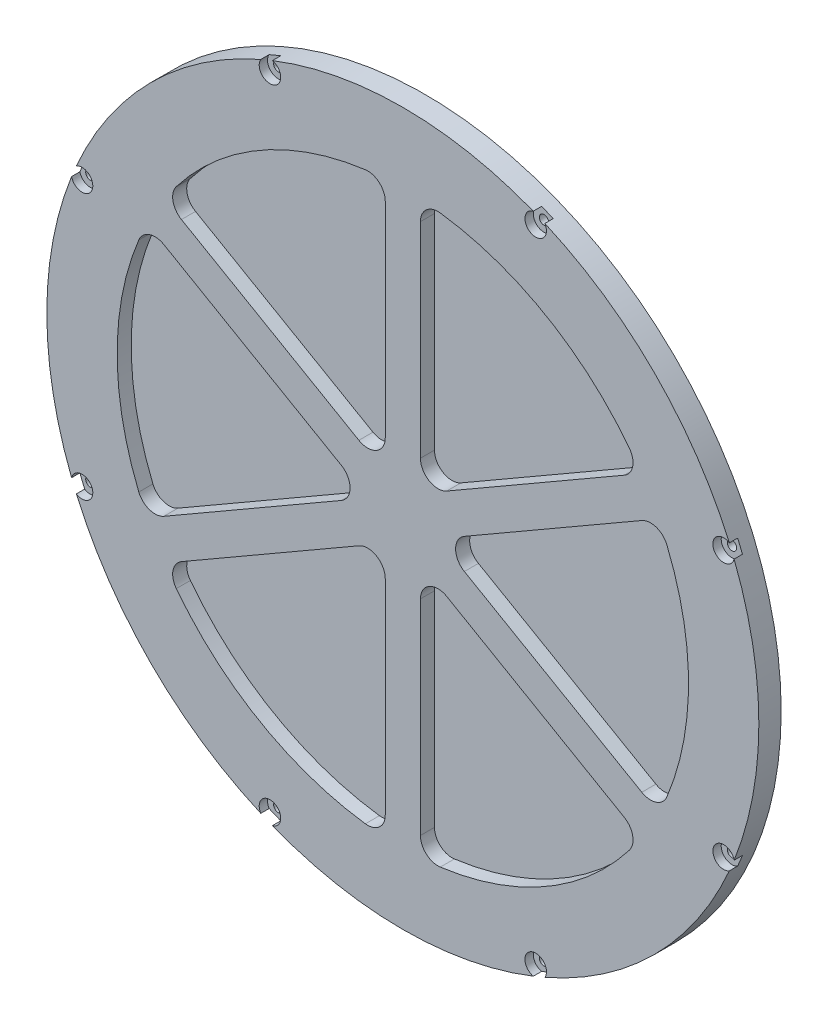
SolidWorks part; units mm, degrees
ref_plane "Front Plane" through (0, 0, 0) normal (0, 0, 1) x (1, 0, 0)
ref_plane "Top Plane" through (0, 0, 0) normal (0, 1, 0) x (1, 0, 0)
ref_plane "Right Plane" through (0, 0, 0) normal (1, 0, 0) x (0, 0, -1)
sketch "Sketch1" plane through (0, 0, 0) normal (0, 0, 1) x (1, 0, 0)
  line L0 (0, 74.0826) -> (0, -98.2025) construction
  line L1 (-101.5333, 0) -> (146.3274, 0) construction
  circle A0 centre (0, 0) radius 202.5
  dimension "D2" = 405
extrude "Boss-Extrude1" add sketch "Sketch1" along normal mid plane 12.7
sketch "Sketch2" plane through (0, 0, 6.35) normal (0, 0, 1) x (1, 0, 0)
  line L0 (0, 212.952) -> (0, -223.7918) construction
  line L1 (-207.1672, 0) -> (208.5976, 0) construction
  line L2 (197.5, 81.8072) -> (197.5, -81.8072) construction
  line L3 (-197.5, 81.8072) -> (-197.5, -81.8072) construction
  line L4 (-197.5, -81.8072) -> (-81.8072, -197.5) construction
  line L5 (81.8072, -197.5) -> (197.5, -81.8072) construction
  line L6 (81.8072, -197.5) -> (-81.8072, -197.5) construction
  line L7 (-197.5, 81.8072) -> (-81.8072, 197.5) construction
  line L8 (81.8072, 197.5) -> (197.5, 81.8072) construction
  line L9 (81.8072, 197.5) -> (-81.8072, 197.5) construction
  dimension "D1" = 197.5
  dimension "D2" = 197.5
  dimension "D3" = 135
  dimension "D4" = 135
  dimension "D5" = 197.5
sketch "Sketch3" plane through (0, 0, 6.35) normal (0, 0, 1) x (1, 0, 0)
  line L0 (-44.7214, 197.5) -> (44.7214, 197.5)
  line L1 (108.0308, 171.2764) -> (171.2764, 108.0308)
  line L2 (197.5, 44.7214) -> (197.5, -44.7214)
  line L3 (171.2764, -108.0308) -> (108.0308, -171.2764)
  line L4 (44.7214, -197.5) -> (-44.7214, -197.5)
  line L5 (-108.0308, -171.2764) -> (-171.2764, -108.0308)
  line L6 (-197.5, -44.7214) -> (-197.5, 44.7214)
  line L7 (-171.2764, 108.0308) -> (-108.0308, 171.2764)
  line L9 (-197.5, -81.8072) -> (-81.8072, -197.5) construction
  arc A0 (108.0308, 171.2764) -> (44.7214, 197.5) centre (0, 0) ccw
  arc A1 (-44.7214, 197.5) -> (-108.0308, 171.2764) centre (0, 0) ccw
  arc A2 (-171.2764, 108.0308) -> (-197.5, 44.7214) centre (0, 0) ccw
  arc A3 (-197.5, -44.7214) -> (-171.2764, -108.0308) centre (0, 0) ccw
  arc A4 (-108.0308, -171.2764) -> (-44.7214, -197.5) centre (0, 0) ccw
  arc A5 (44.7214, -197.5) -> (108.0308, -171.2764) centre (0, 0) ccw
  arc A6 (171.2764, -108.0308) -> (197.5, -44.7214) centre (0, 0) ccw
  arc A7 (197.5, 44.7214) -> (171.2764, 108.0308) centre (0, 0) ccw
  dimension "D1" = 405
extrude "Cut-Extrude1" [suppressed] cut sketch "Sketch3" against normal blind 406.4 flip side to cut
sketch "Sketch10" plane through (0, 0, 6.35) normal (0, 0, -1) x (-1, 0, 0)
  line L0 (77.4934, 187.0856) -> (-77.4934, -187.0856) construction
  line L1 (77.4934, -187.0856) -> (-77.4934, 187.0856) construction
  line L2 (187.0856, 77.4934) -> (-187.0856, -77.4934) construction
  line L3 (-187.0856, 77.4934) -> (187.0856, -77.4934) construction
  circle A0 centre (0, 0) radius 202.5 construction
  circle A1 centre (0, 0) radius 202.5 construction
  circle A2 centre (0, 0) radius 202.5 construction
  circle A3 centre (0, 0) radius 202.5 construction
  circle A4 centre (0, 0) radius 202.5 construction
  circle A5 centre (0, 0) radius 202.5 construction
  circle A6 centre (0, 0) radius 202.5 construction
  circle A7 centre (0, 0) radius 202.5 construction
  circle A8 centre (0, 0) radius 197.5 construction
  circle A9 centre (182.4662, 75.58) radius 2.2479
  circle A10 centre (75.58, 182.4662) radius 2.2479
  circle A11 centre (-75.58, 182.4662) radius 2.2479
  circle A12 centre (182.4662, -75.58) radius 2.2479
  circle A13 centre (75.58, -182.4662) radius 2.2479
  circle A14 centre (-182.4662, 75.58) radius 2.2479
  circle A15 centre (-182.4662, -75.58) radius 2.2479
  circle A16 centre (-75.58, -182.4662) radius 2.2479
  dimension "D1" = 395
  dimension "D2" = 4.4958
extrude "Cut-Extrude3" [suppressed] cut sketch "Sketch10" against normal up to surface (10 mm away)
hole_wizard "CBORE for M5 Hex Head Bolt1" positions "3DSketch1" profile "Sketch11" counterbore size "M5" standard "Ansi Metric"
sketch3d "3DSketch1"
  point P0 (-75.58, 182.4662, 6.35)
sketch "Sketch11" plane through (-75.58, 182.4662, 6.35) normal (1, 0, 0) x (0, -1, 0)
  line L0 (0, 0) -> (0, 12.7)
  line L1 (0, 12.7) -> (2.65, 12.7)
  line L3 (2.65, 12.7) -> (2.65, 4.74)
  line L4 (2.65, 4.74) -> (6.12, 4.74)
  line L5 (6.12, 4.74) -> (6.12, 0)
  line L7 (6.12, 0) -> (0, 0)
  line L11 (0, -6.35) -> (0, 107.95) construction
  dimension "Thru Hole Dia." = 5.3
  dimension "Thru Hole Depth" = 12.7
  dimension "C'Bore Dia." = 12.24
  dimension "C'Bore Depth" = 4.74
sketch "Sketch13" plane through (0, 0, 6.35) normal (0, 0, 1) x (1, 0, 0)
  line L0 (0, 219.8273) -> (0, -231.8135) construction
  line L1 (10, 151.1828) -> (10, 34.641)
  line L2 (206.514, 119.2309) -> (-206.514, -119.2309) construction
  line L3 (-218.6634, 126.2454) -> (218.6634, -126.2454) construction
  line L4 (-10, 151.1828) -> (-10, 34.641)
  line L5 (-125.9282, 84.2517) -> (-25, 25.9808)
  line L6 (125.9282, -84.2517) -> (25, -25.9808)
  line L7 (125.9282, 84.2517) -> (25, 25.9808)
  line L8 (-125.9282, -84.2517) -> (-25, -25.9808)
  line L9 (-35, -8.6603) -> (-135.9282, -66.9312)
  line L10 (35, -8.6603) -> (135.9282, -66.9312)
  line L12 (-10, -34.641) -> (-10, -151.1828)
  line L13 (-35, 8.6603) -> (-135.9282, 66.9312)
  line L14 (35, 8.6603) -> (135.9282, 66.9312)
  line L15 (10, -34.641) -> (10, -151.1828)
  arc A0 (128.8579, 99.0045) -> (21.3115, 161.0965) centre (0, 0) ccw
  arc A1 (150.1694, -62.092) -> (150.1694, 62.092) centre (0, 0) ccw
  arc A2 (-128.8579, -99.0045) -> (-21.3115, -161.0965) centre (0, 0) ccw
  arc A3 (-150.1694, 62.092) -> (-150.1694, -62.092) centre (0, 0) ccw
  arc A4 (-21.3115, 161.0965) -> (-128.8579, 99.0045) centre (0, 0) ccw
  arc A5 (21.3115, -161.0965) -> (128.8579, -99.0045) centre (0, 0) ccw
  arc A6 (-25, 25.9808) -> (-10, 34.641) centre (-20, 34.641) ccw
  arc A7 (-10, 151.1828) -> (-21.3115, 161.0965) centre (-20, 151.1828) ccw
  arc A8 (-128.8579, 99.0045) -> (-125.9282, 84.2517) centre (-120.9282, 92.9119) ccw
  arc A9 (-135.9282, -66.9312) -> (-150.1694, -62.092) centre (-140.9282, -58.2709) cw
  arc A10 (-135.9282, 66.9312) -> (-150.1694, 62.092) centre (-140.9282, 58.2709) ccw
  arc A11 (-35, -8.6603) -> (-35, 8.6603) centre (-40, 0) ccw
  arc A12 (-10, -34.641) -> (-25, -25.9808) centre (-20, -34.641) ccw
  arc A13 (-128.8579, -99.0045) -> (-125.9282, -84.2517) centre (-120.9282, -92.9119) cw
  arc A14 (-21.3115, -161.0965) -> (-10, -151.1828) centre (-20, -151.1828) ccw
  arc A15 (128.8579, -99.0045) -> (125.9282, -84.2517) centre (120.9282, -92.9119) ccw
  arc A16 (21.3115, -161.0965) -> (10, -151.1828) centre (20, -151.1828) cw
  arc A17 (10, -34.641) -> (25, -25.9808) centre (20, -34.641) cw
  arc A18 (35, -8.6603) -> (35, 8.6603) centre (40, 0) cw
  arc A19 (135.9282, -66.9312) -> (150.1694, -62.092) centre (140.9282, -58.2709) ccw
  arc A20 (150.1694, 62.092) -> (135.9282, 66.9312) centre (140.9282, 58.2709) ccw
  arc A21 (125.9282, 84.2517) -> (128.8579, 99.0045) centre (120.9282, 92.9119) ccw
  arc A22 (25, 25.9808) -> (10, 34.641) centre (20, 34.641) cw
  arc A23 (10, 151.1828) -> (21.3115, 161.0965) centre (20, 151.1828) cw
  point P27 (-10, 162.192)
  point P37 (-145.4624, 72.4358)
  point P40 (-20, 0)
  point P45 (-135.4624, -89.7563)
  point P48 (-10, -162.192)
  point P53 (10, -162.192)
  point P58 (20, 0)
  point P61 (145.4624, -72.4358)
  dimension "D1" = 325
  dimension "D7" = 10
  dimension "D2" = 60
  dimension "D3" = 60
  dimension "D4" = 20
  dimension "D5" = 20
  dimension "D6" = 20
extrude "Cut-Extrude4" cut sketch "Sketch13" against normal blind 8
pattern_circular "CirPattern1" count 8 over 360 about axis through (0, 0, 0) along (0, 0, 1) of "CBORE for M5 Hex Head Bolt1"
